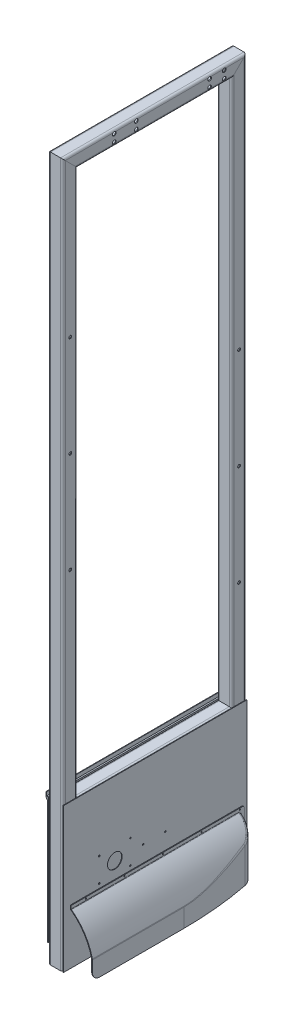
SolidWorks part; units mm, degrees
other "<Side Door_1>-<Cut-Extrude8[1]>"
other "<Side Door_1>-<Cut-Extrude4>"
other "<Side Door_1>-<Boss-Extrude2>"
other "<Side Door_1>-<Cut-Extrude8[3]>"
other "<Side Door_1>-<40x40x2 40X 40 X 2.0(1)[5]>"
other "<Side Door_1>-<LPattern1[2]>"
other "<Side Door_1>-<Cut-Extrude1>"
other "<Side Door_1>-<40x40x2 40X 40 X 2.0(1)[2]>"
other "<Side Door_1>-<Cut-Extrude8[2]>"
ref_plane "Front Plane" through (0, 0, 0) normal (0, 0, 1) x (1, 0, 0)
ref_plane "Top Plane" through (0, 0, 0) normal (0, 1, 0) x (1, 0, 0)
ref_plane "Right Plane" through (0, 0, 0) normal (1, 0, 0) x (0, 0, -1)
mirrored part "Side Door_1_Mirrored"
